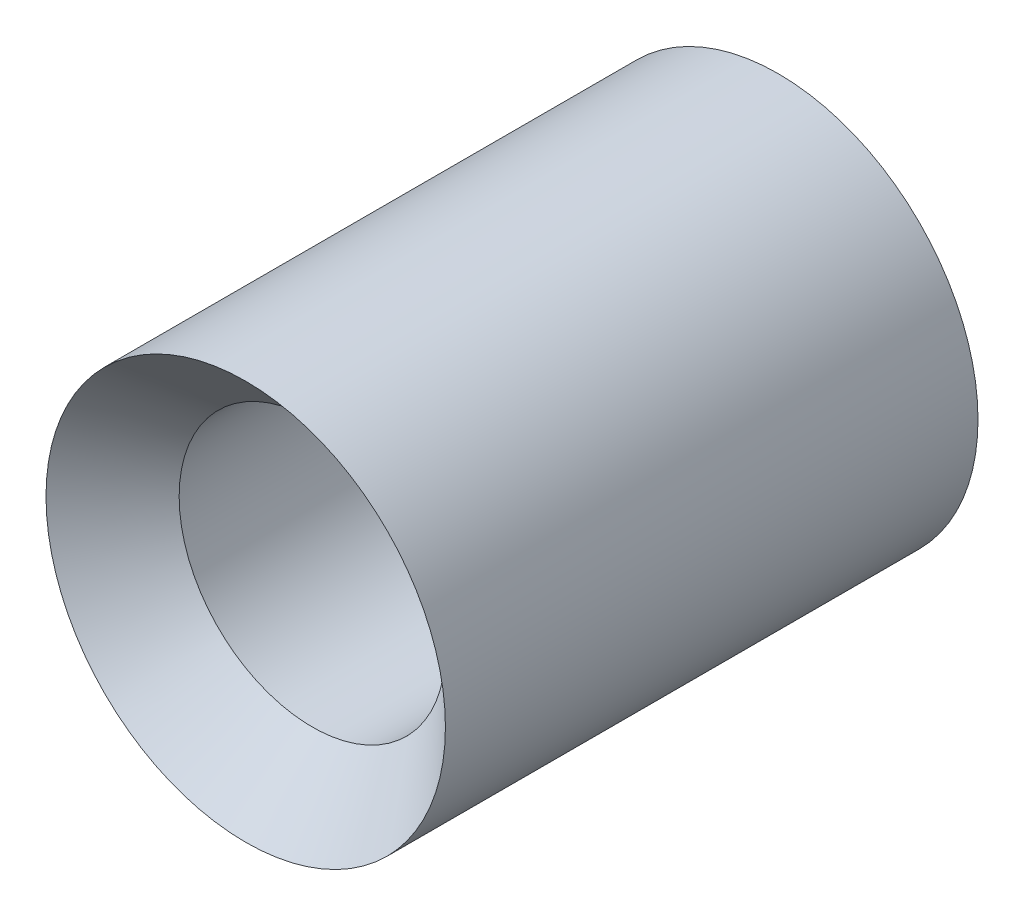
SolidWorks part; units mm, degrees
ref_plane "Plan de face" through (0, 0, 0) normal (0, 0, 1) x (1, 0, 0)
ref_plane "Plan de dessus" through (0, 0, 0) normal (0, 1, 0) x (1, 0, 0)
ref_plane "Plan de droite" through (0, 0, 0) normal (1, 0, 0) x (0, 0, -1)
sketch "Esquisse2" plane through (0, 0, 0) normal (0, 0, 1) x (1, 0, 0)
  circle A0 centre (0, 0) radius 7.5
  circle A1 centre (0, 0) radius 5
  dimension "D1" = 10
  dimension "D2" = 15
extrude "Boss.-Extru.1" add sketch "Esquisse2" along normal blind 20
chamfer "Chanfrein1" distance 2.5 angle 45 1 edges at (5, 0, 20)
